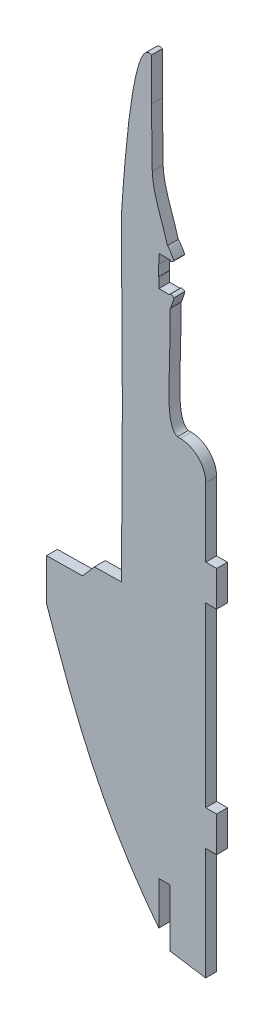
SolidWorks part; units mm, degrees
ref_plane "Alzado" through (0, 0, 0) normal (0, 0, 1) x (1, 0, 0)
ref_plane "Planta" through (0, 0, 0) normal (0, 1, 0) x (1, 0, 0)
ref_plane "Vista lateral" through (0, 0, 0) normal (1, 0, 0) x (0, 0, -1)
sketch "Croquis2" plane through (0, 0, 0) normal (0, 0, 1) x (1, 0, 0)
sketch_block_instance "F1 CAR CUT corte-1"
sketch_block "Bloque1"
extrude "Saliente-Extruir1" add sketch "Croquis2" along normal blind 3
delete or keep bodies "Sólido-Eliminar/Conservar 19" type delete bodies bodies 102 101 103 112 108 104 113 114
delete or keep bodies "Sólido-Eliminar/Conservar 20" type delete bodies bodies 107 105
delete or keep bodies "Sólido-Eliminar/Conservar 21" type delete bodies bodies 109
delete or keep bodies "Sólido-Eliminar/Conservar 22" type delete bodies bodies 110
delete or keep bodies "Sólido-Eliminar/Conservar 23" type delete bodies bodies 106
